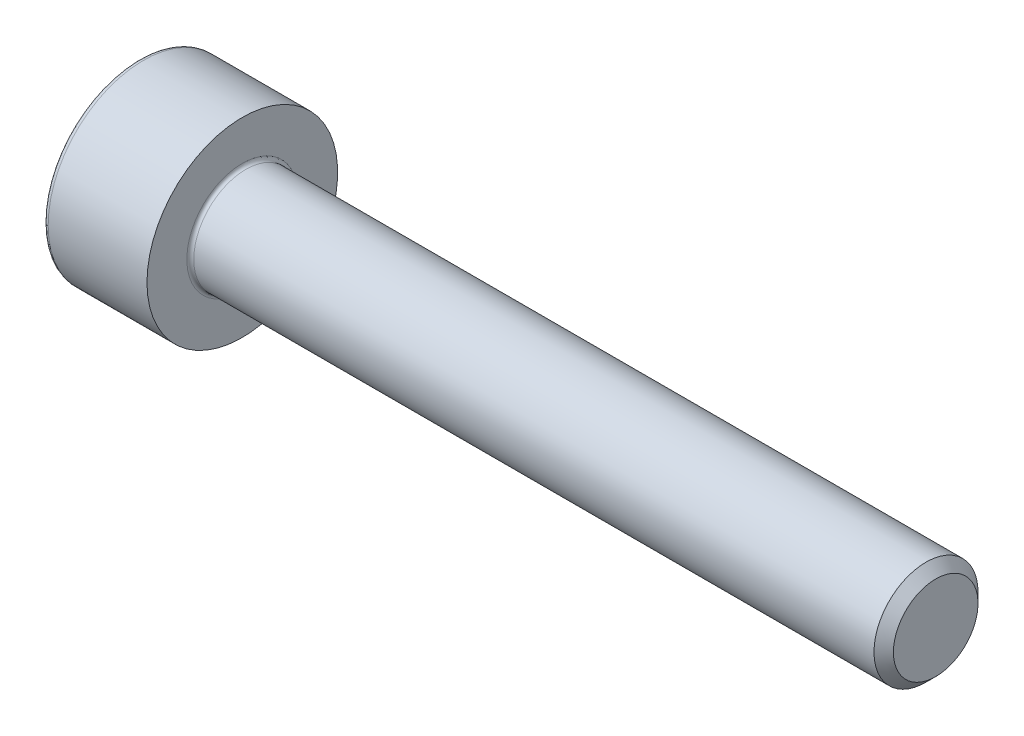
SolidWorks part; units mm, degrees
revolve "Base-Revolve" add sketch "BodySke"
sketch "BodySke" plane through (0, 0, 0) normal (0, 0, 1) x (1, 0, 0)
  line L0 (0, 0) -> (0, 2.75)
  line L1 (0, 2.75) -> (3, 2.75)
  line L2 (3, 2.75) -> (3, 1.5)
  line L3 (3, 1.5) -> (22.7195, 1.5)
  line L4 (23, 1.2195) -> (23, 0)
  line L5 (23, 0) -> (0, 0)
  line L6 (-31.75, 0) -> (127, 0) construction
  line L8 (23, 1.2195) -> (22.7195, 1.5)
  line L10 (23, -1.2195) -> (22.7195, -1.5) construction
  line L11 (3.5, 9.525) -> (3.5, 3.175) construction
  line L12 (3, 9.525) -> (3, 3.175) construction
  line L13 (-37, 9.525) -> (-37, 3.175) construction
fillet "Fillet1" radius 0.1 1 edges at (3, 0, 1.5)
fillet "Fillet2" radius 0.15 1 edges at (0, 0, 2.75)
ref_plane "Plane1" through (0, 0, 0) normal (0, 0, 1) x (1, 0, 0)
ref_plane "Plane2" through (0, 0, 0) normal (0, 1, 0) x (1, 0, 0)
ref_plane "Plane3" through (0, 0, 0) normal (1, 0, 0) x (0, 0, -1)
other "Configuration Table"
sketch "Sketch2" plane through (0, 0, 0) normal (0, 0, 1) x (1, 0, 0)
  line L0 (0, 1.28) -> (1.3, 1.28)
  line L1 (1.3, 1.28) -> (2.039, 0)
  line L2 (-31.75, 0) -> (127, 0) construction
  line L3 (2.039, 0) -> (0, 0)
  line L4 (0, 0) -> (0, 1.28)
  line L6 (0, 0) -> (47.625, 0) construction
revolve "Hex-PreBroach" cut sketch "Sketch2" angle 360 about L6
sketch "Sketch3" plane through (0, 0, 0) normal (-1, 0, 0) x (0, 0.5, 0.866)
  line L0 (0.739, 1.28) -> (-0.739, 1.28)
  line L1 (-0.739, 1.28) -> (-1.478, 0)
  line L2 (0.739, 1.28) -> (1.478, 0)
  line L3 (0.739, -1.28) -> (1.478, 0)
  line L4 (0.739, -1.28) -> (-0.739, -1.28)
  line L5 (-0.739, -1.28) -> (-1.478, 0)
extrude "Hex" cut sketch "Sketch3" against normal blind 1.3
sketch "ThdSchSke" plane through (0, 0, 0) normal (0, 0, 1) x (1, 0, 0)
  line L0 (4.5, -1.2195) -> (4.3036, -1.5)
  line L1 (4.5, -1.2195) -> (4.6964, -1.5)
  line L2 (4.6964, -1.5) -> (4.6964, -1.875)
  line L3 (-3.175, 0) -> (5.1513, 0) construction
  line L4 (0, 2.6) -> (0, -2.6) construction
  line L5 (4.6964, -1.875) -> (4.3036, -1.875)
  line L6 (4.3036, -1.875) -> (4.3036, -1.5)
revolve "ThreadSchematic" [suppressed] cut sketch "ThdSchSke" angle 360 about L3
pattern_linear "ThdSchPat" [suppressed]
equation "\"D2@Sketch3\" = \"Hex_size@Sketch3\" / 2"
equation "\"D1@Sketch3\" = \"Hex_size@Sketch3\" / 2"
equation "\"D1@Sketch2\" = \"Hex_size@Sketch3\" / 2"
equation "\"Thread_minor@ThreadCosmetic\"  =  \"Minor_dia@BodySke\""
equation "\"Depth@Sketch2\" =  \"Key_eng@Hex\""
equation "\"Thread_length@ThreadCosmetic\" = ((sgn( (\"Length@BodySke\" - \"Advance@BodySke\" * 3.0) - \"Thread_nom@BodySke\" )-1)*( (\"Length@BodySke\" - \"Advance@BodySke\" * 3.0) - \"Thread_nom@BodySke\" ))/-2+ \"Thread_no"
equation "\"Thread_minor@ThdSchSke\" = \"Minor_dia@BodySke\""
equation "\"Diameter@ThdSchSke\" = \"Diameter@BodySke\""
equation "\"Overcut@ThdSchSke\" = \"Diameter@BodySke\" * 1.25"
equation "\"Start@ThdSchSke\" = \"Head_ht@BodySke\" + \"Length@BodySke\" - \"Thread_length@ThreadCosmetic\"  '---Non-countersunk---"
equation "\"Num_threads@ThdSchPat\" = int( \"Thread_length@ThreadCosmetic\" / \"Advance@BodySke\" + 0.999 )  + 1"
equation "\"Advance@ThdSchPat\" = \"Thread_length@ThreadCosmetic\" /  (\"Num_threads@ThdSchPat\" - 1) 'relax it"
equation "\"Num_threads@ThdSchPat\" = \"Num_threads@ThdSchPat\" - sgn( \"Num_threads@ThdSchPat\" - 1) '---chamfered tips only---"
